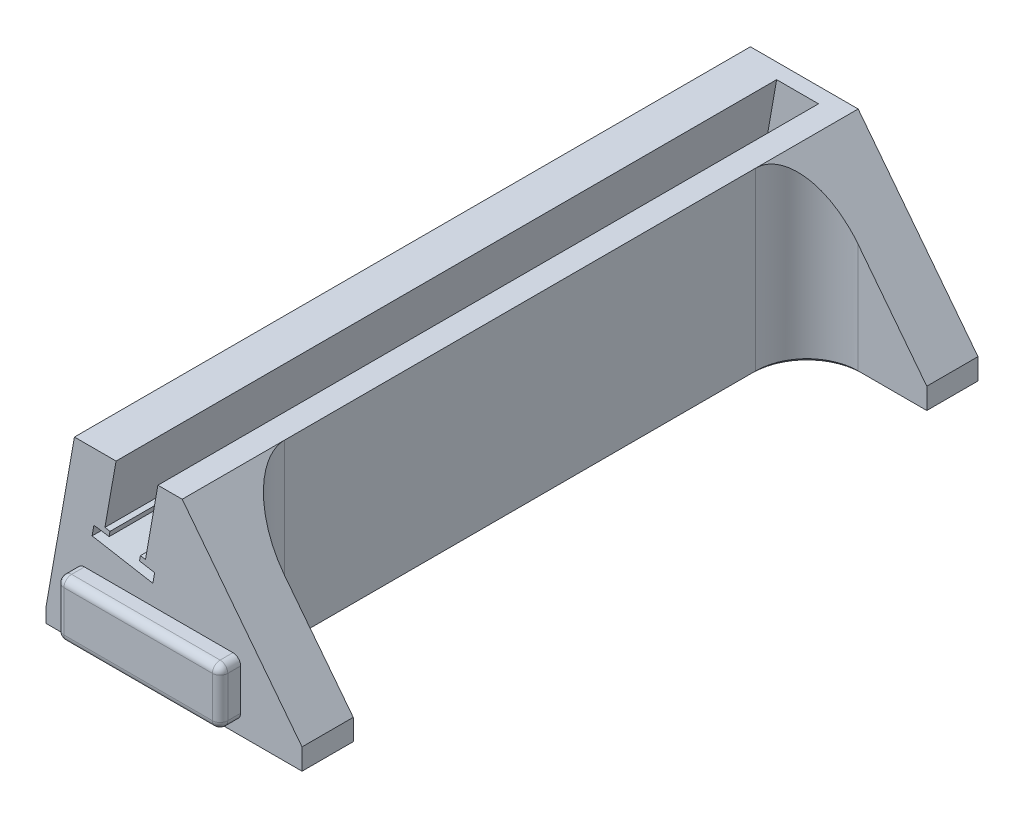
SolidWorks part; units mm, degrees
ref_plane "Front" through (0, 0, 0) normal (0, 0, 1) x (1, 0, 0)
ref_plane "Top" through (0, 0, 0) normal (0, 1, 0) x (1, 0, 0)
ref_plane "Right" through (0, 0, 0) normal (1, 0, 0) x (0, 0, -1)
sketch "Skizze1" plane through (0, 0, 0) normal (0, 0, 1) x (1, 0, 0)
  line L0 (-19.4436, 15) -> (-25, -16.5121)
  line L1 (-19.4436, 15) -> (-11.3202, 15)
  line L2 (-25, -16.5121) -> (-25, -20)
  line L3 (-25, -20) -> (25, -20)
  line L4 (25, -15.1842) -> (25, -20)
  line L5 (-11.3202, 15) -> (-13.4914, 2.6865)
  line L7 (-5.5771, 1.2127) -> (-3.146, 15)
  line L8 (-3.146, 15) -> (1.5959, 15)
  line L9 (-13.665, 1.7017) -> (-15.6466, 1.9728)
  line L10 (-5.7507, 0.2279) -> (-3.7811, -0.1194)
  line L11 (-15.6466, 1.9728) -> (-15.9953, 0.0034)
  line L12 (-3.7811, -0.1194) -> (-4.1284, -2.089)
  line L13 (-15.9953, 0.0034) -> (-4.1284, -2.089)
  line L14 (-13.665, 1.7017) -> (-12.6802, 1.5281)
  line L16 (-12.6802, 1.5281) -> (-12.5066, 2.5129)
  line L17 (-13.4914, 2.6865) -> (-12.5066, 2.5129)
  line L18 (-5.7507, 0.2279) -> (-6.7355, 0.4015)
  line L20 (-6.7355, 0.4015) -> (-6.5619, 1.3863)
  line L21 (-5.5771, 1.2127) -> (-6.5619, 1.3863)
  line L22 (25, -15.1842) -> (1.5959, 15)
  point P13 (-12.5934, 2.0205)
  point P19 (-6.2431, 0.3147)
  dimension "D1" = 50
  dimension "D2" = 35
  dimension "D3" = 15
  dimension "D4" = 25
  dimension "D5" = 10
  dimension "D6" = 8
  dimension "D7" = 8.05
  dimension "D8" = 15
  dimension "D9" = 2
  dimension "D10" = 2
  dimension "D11" = 2
  dimension "D12" = 2
  dimension "D13" = 1
  dimension "D14" = 1
  dimension "D15" = 1
  dimension "D16" = 1
extrude "Aufsatz-Linear austragen1" add sketch "Skizze1" along normal blind 132
sketch "Skizze2" plane through (0, 15, 0) normal (0, 1, 0) x (1, 0, 0)
  line L0 (1.5959, -132) -> (1.5959, 0) construction
  line L1 (25, -132) -> (25, 0) construction
  line L2 (1.5959, -10) -> (25, -10)
  line L3 (1.5959, -10) -> (1.5959, -122)
  line L4 (1.5959, -122) -> (25, -122)
  line L5 (25, -10) -> (25, -122)
  line L6 (25, 0) -> (1.5959, 0) construction
  line L7 (25, -132) -> (1.5959, -132) construction
  dimension "D1" = 10
  dimension "D2" = 10
extrude "Schnitt-Linear austragen1" cut sketch "Skizze2" against normal through all
fillet "Verrundung1" radius 10 2 edges at (1.5959, -2.5, 122) (1.5959, -2.5, 10)
sketch "Skizze3" plane through (0, 0, 132) normal (0, 0, 1) x (1, 0, 0)
  line L0 (-25, -16.5121) -> (-25, -20) construction
  line L1 (-19, -6) -> (13, -6)
  line L2 (-19, -6) -> (-19, -17)
  line L3 (-19, -17) -> (13, -17)
  line L4 (13, -6) -> (13, -17)
  line L5 (25, -20) -> (25, -15.1842) construction
  line L6 (-25, -20) -> (25, -20) construction
  dimension "D1" = 6
  dimension "D2" = 12
  dimension "D3" = 3
  dimension "D4" = 11
sketch "Skizze4" plane through (0, -20, 0) normal (0, -1, 0) x (1, 0, 0)
  line L0 (-25, 132) -> (25, 132) construction
  line L1 (-21, 121) -> (-2.4041, 121)
  line L2 (-21, 121) -> (-21, 11)
  line L3 (-21, 11) -> (-2.4041, 11)
  line L4 (-2.4041, 121) -> (-2.4041, 11)
  line L5 (-25, 0) -> (25, 0) construction
  line L6 (-25, 132) -> (-25, 0) construction
  line L7 (1.5959, 20) -> (1.5959, 112) construction
  dimension "D1" = 11
  dimension "D2" = 11
  dimension "D3" = 4
  dimension "D4" = 4
extrude "Schnitt-Linear austragen3" cut sketch "Skizze4" against normal blind 12
extrude "Aufsatz-Linear austragen2" add sketch "Skizze3" along normal blind 4
fillet "Verrundung2" radius 1.5 8 edges at (-3, -6, 136) (13, -11.5, 136) (-3, -17, 136) (-19, -11.5, 136) (-19, -17, 134) (-19, -6, 134) (13, -17, 134) (13, -6, 134)
sketch "Skizze5" plane through (0, 0, 0) normal (0, 0, -1) x (-1, 0, 0)
  line L0 (-1.5959, 15) -> (3.146, 15) construction
  line L1 (-0.2567, 15) -> (17.9209, 15)
  line L2 (-0.2567, 15) -> (-0.2567, -3.1767)
  line L3 (-0.2567, -3.1767) -> (17.9209, -3.1767)
  line L4 (17.9209, 15) -> (17.9209, -3.1767)
extrude "Aufsatz-Linear austragen3" add sketch "Skizze5" against normal blind 3
chamfer "Fase1" distance 0.7 angle 45 14 edges at (0, -20, 0) (-25, -20, 66) (0, -20, 132) (25, -20, 127) (18.298, -20, 122) (4.5249, -20, 119.0711) (1.5959, -20, 66) (4.5249, -20, 12.9289) (18.298, -20, 10) (25, -20, 5) (-2.4041, -20, 66) (-11.702, -20, 121) (-21, -20, 66) (-11.702, -20, 11)
